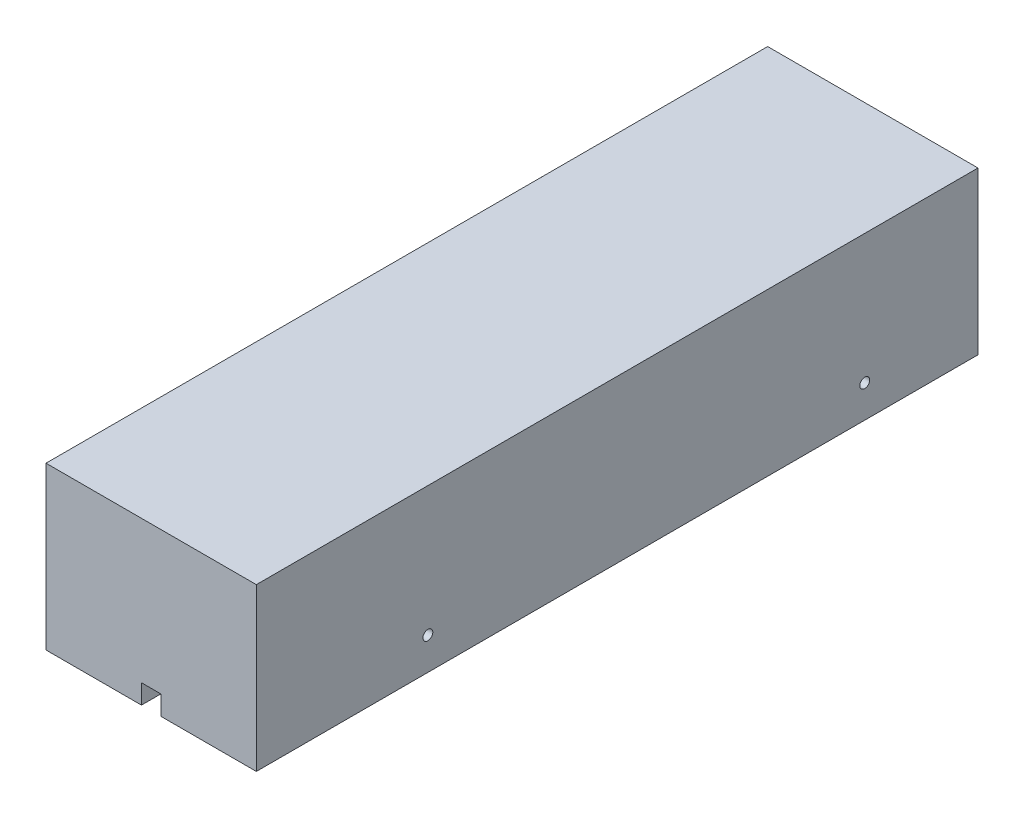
SolidWorks part; units mm, degrees
ref_plane "Front Plane" through (0, 0, 0) normal (0, 0, 1) x (1, 0, 0)
ref_plane "Top Plane" through (0, 0, 0) normal (0, 1, 0) x (1, 0, 0)
ref_plane "Right Plane" through (0, 0, 0) normal (1, 0, 0) x (0, 0, -1)
sketch "Sketch1" plane through (0, 0, 0) normal (0, 0, 1) x (1, 0, 0)
  line L1 (-32.5, 0) -> (32.5, 0)
  line L2 (-32.5, 0) -> (-32.5, 50)
  line L3 (-32.5, 50) -> (32.5, 50)
  line L4 (32.5, 0) -> (32.5, 50)
  dimension "D1" = 65
  dimension "D2" = 50
extrude "Balsa Block" add sketch "Sketch1" along normal blind 223
sketch "Sketch2" plane through (0, 0, 223) normal (0, 0, 1) x (1, 0, 0)
  line L0 (-32.5, 0) -> (32.5, 0) construction
  line L1 (-3, 0) -> (3, 0)
  line L2 (-3, 0) -> (-3, 6)
  line L3 (-3, 6) -> (3, 6)
  line L4 (3, 0) -> (3, 6)
  dimension "D1" = 6
  dimension "D2" = 6
extrude "Screw Eye Slot" cut sketch "Sketch2" against normal through all
sketch "Sketch3" plane through (0, 0, 0) normal (0, 0, -1) x (-1, 0, 0)
  line L0 (32.5, 0) -> (3, 0) construction
  circle A0 centre (0, 29) radius 9.55
  dimension "D1" = 19.1
  dimension "D2" = 29
extrude "CO2 Cartridge Hole" cut sketch "Sketch3" against normal blind 52
sketch "Sketch4" plane through (32.5, 0, 0) normal (1, 0, 0) x (0, 0, -1)
  line L0 (-223, 0) -> (0, 0) construction
  line L1 (0, 0) -> (0, 50) construction
  circle A0 centre (-170, 10) radius 1.525
  circle A1 centre (-35, 10) radius 1.525
  dimension "D4" = 3.05
  dimension "D1" = 10
  dimension "D2" = 135
  dimension "D3" = 35
extrude "Axle Hole Cut Out" cut sketch "Sketch4" against normal through all
sketch "Sketch5" plane through (0, 50, 0) normal (0, 1, 0) x (1, 0, 0)
  line L0 (32.5, 0) -> (-32.5, 0) construction
  line L1 (0, 0) -> (0, -229.7898) construction
  line L2 (-14.55, 0) -> (-14.55, -51.1732)
  line L3 (-17.1047, -57.8491) -> (-25.4453, -67.1509)
  line L4 (-28, -73.8268) -> (-28, -120)
  line L5 (-14.4879, 48.8908) -> (-14.4879, 49.7327) construction
  line L6 (28, -73.8268) -> (28, -120)
  line L7 (17.1047, -57.8491) -> (25.4453, -67.1509)
  line L8 (14.55, 0) -> (14.55, -51.1732)
  line L9 (-14.7766, 49.831) -> (-14.7766, 50.2789) construction
  line L10 (-9.55, 0) -> (-9.55, -52) construction
  line L11 (9.55, -52) -> (9.55, 0) construction
  arc A0 (-25.4453, -67.1509) -> (-28, -73.8268) centre (-18, -73.8268) ccw
  arc A1 (-14.55, -51.1732) -> (-17.1047, -57.8491) centre (-24.55, -51.1732) cw
  arc A2 (14.55, -51.1732) -> (17.1047, -57.8491) centre (24.55, -51.1732) ccw
  arc A3 (25.4453, -67.1509) -> (28, -73.8268) centre (18, -73.8268) cw
  spline S0 degree 3 poles (-28, -120) (-27.6859, -126.0056) (-27.1636, -135.9946) (-19.7034, -144.9636) (-13.3488, -154.8578) (-14.7766, -154.2092) (-14.7766, -173.3072) (-14.4879, -181.2754) (-14.4879, -195.7718) (-8.4397, -210.8954) (-2.3915, -226.019) knots 0 0 0 0 0.179945 0.299298 0.299298 0.625194 0.625194 0.690626 0.690626 1 1 1 1
  spline S1 degree 3 poles (28, -120) (27.6859, -126.0056) (27.1636, -135.9946) (19.7034, -144.9636) (13.3488, -154.8578) (14.7766, -154.2092) (14.7766, -173.3072) (14.4879, -181.2754) (14.4879, -195.7718) (8.4397, -210.8954) (2.3915, -226.019) knots 0 0 0 0 0.179945 0.299298 0.299298 0.625194 0.625194 0.690626 0.690626 1 1 1 1
  spline S2 degree 3 poles (-14.55, 0) (-14.55, -18.3333) (-14.55, -36.6667) (-14.55, -55) knots 0 0 0 0 1 1 1 1
  spline S3 degree 3 poles (14.55, 0) (14.55, -18.3333) (14.55, -36.6667) (14.55, -55) knots 0 0 0 0 1 1 1 1
  dimension "D2" = 5
  dimension "D1" = 5
sketch "Sketch6" plane through (0, 0, 0) normal (1, 0, 0) x (0, 0, -1)
  line L1 (-52, 19.45) -> (0, 19.45) construction
  line L3 (0, 23.65) -> (0, -23.65) construction
  line L10 (-210, 10.9116) -> (-210, 0)
  line L13 (-210, 0) -> (-22.7709, 0)
  spline S0 degree 3 poles (-210, 10.9116) (-202.7227, 13.8598) (-188.783, 19.5071) (-143.7313, 22.444) (-85.5632, 16.1988) (-63.4626, 33.1745) (-61.6089, 55.2214) (-24.8176, 48.2515) (0, 43.55) knots 0 0 0 0 0.060945 0.11674 0.333018 0.333018 0.550088 1 1 1 1
  spline S1 degree 3 poles (-22.7709, 0) (-21.942, 3.2613) (-20.3664, 9.4604) (-11.2641, 16.1435) (-4.1106, 15.068) (0, 14.45) knots 0 0 0 0 0.32075 0.609686 1 1 1 1
  dimension "D3" = 5
  dimension "D1" = 210
  dimension "D2" = 5
sketch "Sketch7" plane through (0, 0, 0) normal (0, 0, -1) x (-1, 0, 0)
  line L0 (18.8348, 21.5) -> (32.5, 21.5)
  line L2 (-18.8348, 21.5) -> (-32.5, 21.5)
  line L5 (0, 0) -> (0, 64.6236) construction
  arc A0 (13.8783, 27.1579) -> (-13.8783, 27.1579) centre (0, 29) ccw
  arc A1 (-13.8783, 27.1579) -> (-18.8348, 21.5) centre (-18.8348, 26.5) cw
  arc A2 (13.8783, 27.1579) -> (18.8348, 21.5) centre (18.8348, 26.5) ccw
  dimension "D1" = 14
  dimension "D3" = 5
  dimension "D2" = 21.5
  dimension "D4" = 65
sketch "Sketch8" plane through (0, 0, 0) normal (1, 0, 0) x (0, 0, -1)
  line L0 (-202.5076, 10) -> (-187, 14)
  line L1 (-187, 14) -> (-187, 6)
  line L2 (-187, 6) -> (-202, 6)
  line L3 (-210, 0) -> (-22.7709, 0) construction
  line L6 (-210, 10.9116) -> (-210, 0) construction
  arc A0 (-202.5076, 10) -> (-202, 6) centre (-202, 8.0322) ccw
  dimension "D1" = 15
  dimension "D2" = 6
  dimension "D3" = 8
  dimension "D4" = 10
  dimension "D5" = 8
extrude "Cut-Extrude1" [suppressed] cut sketch "Sketch5" against normal through all contours S0 L4 A0 L3 A1 L2 M33 M34 M35 | L6 S1 L8 A2 L7 A3 M35 M36 M33
extrude "Cut-Extrude2" [suppressed] cut sketch "Sketch6" against normal through all and the other way through all flip side to cut
extrude "Cut-Extrude3" [suppressed] cut sketch "Sketch7" against normal through all and the other way through all flip side to cut
extrude "Boss-Extrude1" [suppressed] add sketch "Sketch8" along normal mid plane 50
sketch "Sketch9" plane through (0, 0, 0) normal (1, 0, 0) x (0, 0, -1)
  line L0 (-28, 43) -> (-6, 50)
  line L2 (-6, 50) -> (-6, 42)
  line L3 (-8, 40) -> (-26, 40)
  line L4 (-28, 42) -> (-28, 43)
  arc A0 (-26, 40) -> (-28, 42) centre (-26, 42) cw
  arc A1 (-6, 42) -> (-8, 40) centre (-8, 42) cw
  dimension "D1" = 2
  dimension "D3" = 10
  dimension "D4" = 22
extrude "Boss-Extrude2" [suppressed] add sketch "Sketch9" along normal mid plane 50
fillet "Fillet1" [suppressed] radius 3
fillet "Fillet2" [suppressed] radius 12
fillet "VarFillet1" [suppressed] radius 15
